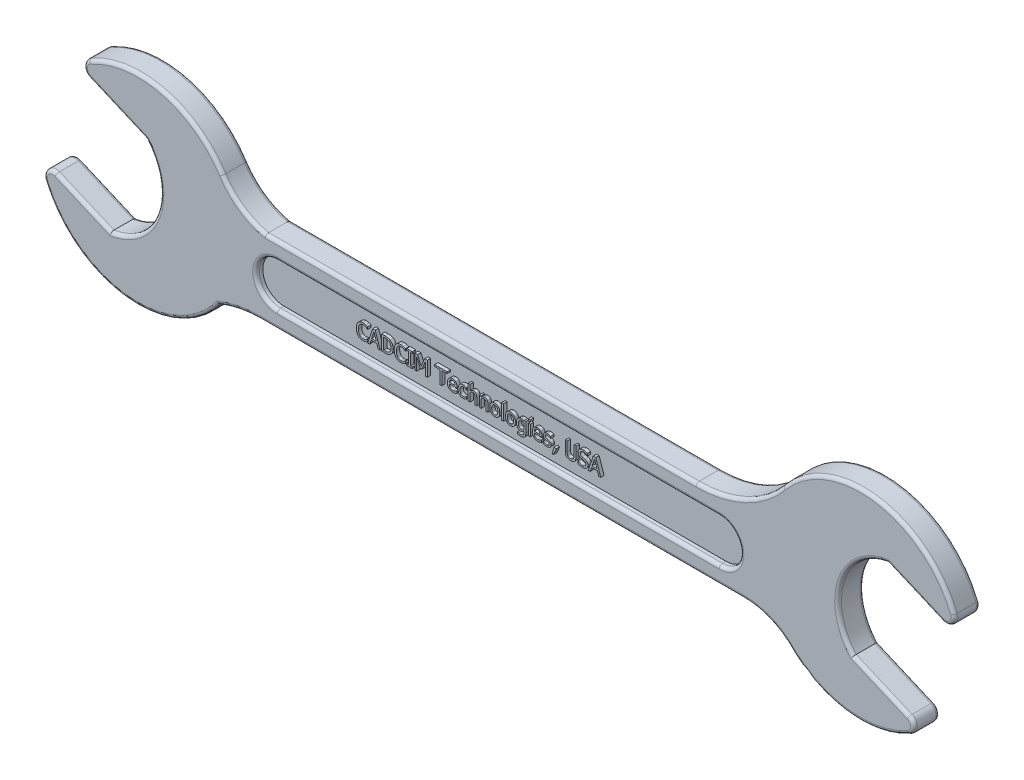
SolidWorks part; units mm, degrees
ref_plane "Plane1" through (0, 0, 0) normal (0, 0, 1) x (1, 0, 0)
ref_plane "Plane2" through (0, 0, 0) normal (0, 1, 0) x (1, 0, 0)
ref_plane "Plane3" through (0, 0, 0) normal (1, 0, 0) x (0, 0, -1)
sketch "Sketch1" plane through (88.7363, -76.0772, 0) normal (0, 0, 1) x (1, 0, 0)
  line L0 (-1.544, 356.8992) -> (39.1367, 339.4646)
  line L1 (-27.7035, 283.5501) -> (14.0318, 265.6635)
  line L5 (-470.0724, 279.9262) -> (-109.3915, 279.9262)
  line L9 (-556.1526, 354.2155) -> (-598.307, 372.2817)
  line L12 (-666.7701, 121.1337) -> (-667.3543, 121.7179) construction
  line L13 (-582.3121, 280.8664) -> (-622.9928, 298.301)
  line L16 (-144.9401, 337.0762) -> (-466.7004, 337.0762)
  arc A0 (-1.544, 356.8992) -> (-27.7035, 283.5501) centre (5.8402, 312.9263) ccw
  arc A1 (14.6382, 253.9295) -> (14.0318, 265.6635) centre (11.4536, 259.6476) ccw
  arc A2 (-109.3915, 279.9262) -> (-71.8166, 263.2767) centre (-109.3915, 229.2016) cw
  arc A3 (-144.9401, 337.0762) -> (-79.9946, 367.6489) centre (-144.9401, 421.3445) ccw
  arc A4 (47.7816, 347.937) -> (-79.9946, 367.6489) centre (-21.9849, 319.6877) ccw
  arc A5 (47.7816, 347.937) -> (39.1367, 339.4646) centre (41.7149, 345.4805) cw
  arc A6 (-71.8166, 263.2767) -> (14.6382, 253.9295) centre (-21.9849, 319.6877) ccw
  arc A7 (-498.7467, 359.1961) -> (-598.6285, 384.1653) centre (-562.0054, 318.4072) ccw
  arc A12 (-582.3121, 280.8664) -> (-556.1526, 354.2155) centre (-589.6963, 324.8393) ccw
  arc A13 (-598.6285, 384.1653) -> (-598.307, 372.2817) centre (-595.7288, 378.2976) ccw
  arc A14 (-466.7004, 337.0762) -> (-498.7467, 359.1961) centre (-456.1159, 386.6842) cw
  arc A15 (-470.0724, 279.9262) -> (-501.2799, 273.9346) centre (-470.0724, 195.6579) ccw
  arc A16 (-631.6377, 289.8286) -> (-501.2799, 273.9346) centre (-562.0054, 318.4072) ccw
  arc A17 (-631.6377, 289.8286) -> (-622.9928, 298.301) centre (-625.571, 292.2851) cw
  dimension "D1" = 57.15
extrude "Base-Extrude" add sketch "Sketch1" along normal mid plane 19.05
sketch "Sketch2" plane through (0, 0, 9.525) normal (0, 0, 1) x (1, 0, 0)
  line L0 (-56.2038, 260.999) -> (-377.964, 260.999) construction
  line L1 (-369.0587, 248.299) -> (-38.8587, 248.299)
  line L3 (-369.0587, 216.549) -> (-38.8587, 216.549)
  arc A0 (-369.0587, 248.299) -> (-369.0587, 216.549) centre (-369.0587, 232.424) ccw
  arc A1 (-38.8587, 248.299) -> (-38.8587, 216.549) centre (-38.8587, 232.424) cw
  dimension "D1" = 31.75
  dimension "D2" = 330.2
  dimension "D3" = 12.7
extrude "Cut-Extrude1" cut sketch "Sketch2" against normal blind 5.08
ref_plane "Plane4" through (0, 0, 0) normal (0, 0, 1) x (1, 0, 0)
mirror "Mirror1" about plane through (0, 0, 0) normal (0, 0, 1)
fillet "Fillet1" radius 2.54
sketch "Sketch3" plane through (0, 0, 4.445) normal (0, 0, 1) x (1, 0, 0)
  text T0 "CADCIM Technologies, USA" font "Tahoma" height 3.5
  point P0 (-311.9966, 226.5286)
extrude "Boss-Extrude1" add sketch "Sketch3" along normal blind 2.54
